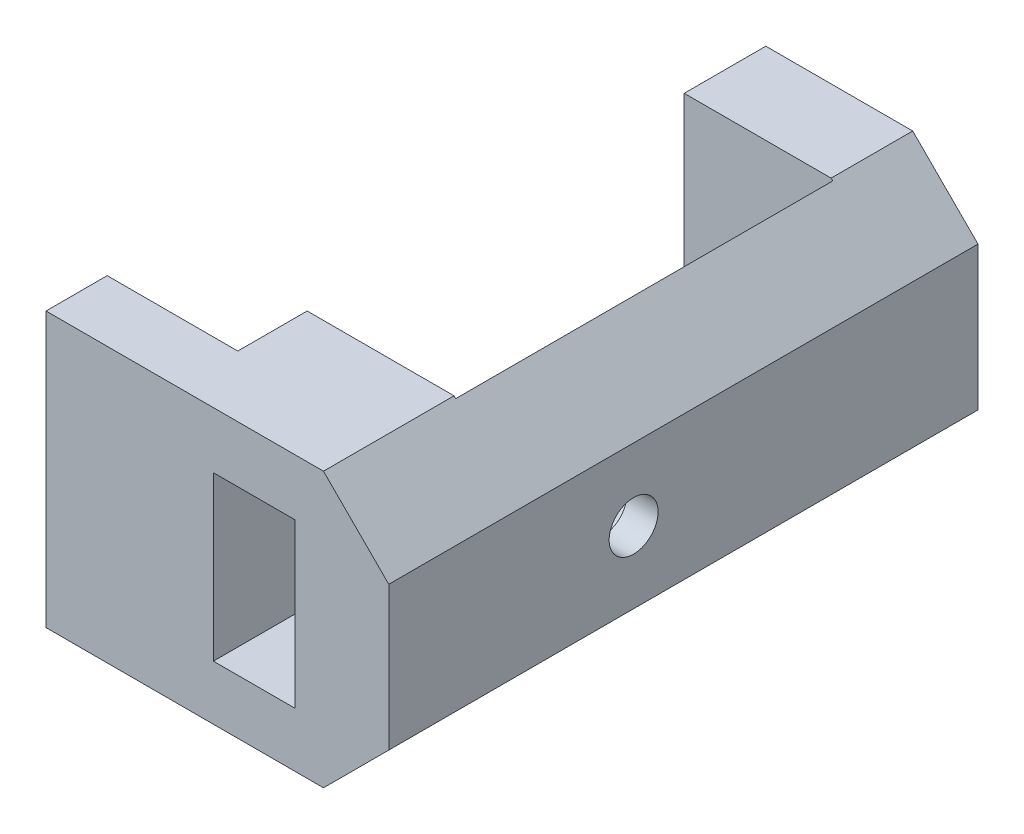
SolidWorks part; units mm, degrees
ref_plane "Front" through (0, 0, 0) normal (0, 0, 1) x (1, 0, 0)
ref_plane "Top" through (0, 0, 0) normal (0, 1, 0) x (1, 0, 0)
ref_plane "Right" through (0, 0, 0) normal (1, 0, 0) x (0, 0, -1)
sketch "Sketch1" plane through (0, 0, 0) normal (0, 1, 0) x (1, 0, 0)
  line L0 (0, 0) -> (13, 0)
  line L1 (13, 0) -> (13, 33.1)
  line L2 (0, 0) -> (0, 5)
  line L3 (0, 5) -> (9.1, 5)
  line L4 (9.1, 5) -> (9.1, 28.1)
  line L5 (13, 16.55) -> (-7.0543, 16.55) construction
  line L6 (0, 28.1) -> (9.1, 28.1)
  line L7 (0, 33.1) -> (0, 28.1)
  line L8 (0, 33.1) -> (13, 33.1)
  point P12 (9.1, 16.55)
  dimension "D1" = 5
  dimension "D2" = 13
  dimension "D3" = 9.1
  dimension "D4" = 16.55
extrude "Boss-Extrude1" add sketch "Sketch1" along normal blind 16.8
sketch "Sketch3" plane through (13, 0, 0) normal (1, 0, 0) x (0, 0, -1)
  line L0 (0, 8.4) -> (33.1, 8.4) construction
  line L1 (0, 16.8) -> (0, 0) construction
  line L2 (33.1, 16.8) -> (33.1, 0) construction
  circle A0 centre (12, 8.4) radius 1.5
  dimension "D1" = 3
  dimension "D2" = 12
extrude "Cut-Extrude2" cut sketch "Sketch3" against normal blind 10
sketch "Sketch5" plane through (9.1, 0, 0) normal (-1, 0, 0) x (0, 0, 1)
  line L1 (-13.9861, 11.8278) -> (-15.8738, 7.5703)
  line L2 (-15.8738, 7.5703) -> (-12.408, 4.4595)
  line L3 (-12.408, 4.4595) -> (-8.3784, 6.7943)
  line L4 (-8.3784, 6.7943) -> (-9.3537, 11.3482)
  line L5 (-9.3537, 11.3482) -> (-13.9861, 11.8278)
  circle A0 centre (-12, 8.4) radius 3.205 construction
  dimension "D1" = 6.41
extrude "Cut-Extrude4" cut sketch "Sketch5" against normal blind 2
chamfer "Chamfer1" distance 4 angle 45 2 edges at (13, 16.8, -16.55) (13, 0, -16.55)
sketch "Sketch7" plane through (0, 0, 0) normal (0, 0, 1) x (1, 0, 0)
  line L0 (0, 0) -> (9, 0)
  line L1 (9, 0) -> (13, 4)
  line L2 (13, 4) -> (13, 12.8)
  line L3 (13, 12.8) -> (9, 16.8)
  line L4 (9, 16.8) -> (0, 16.8)
  line L5 (0, 16.8) -> (0, 0)
extrude "Boss-Extrude2" add sketch "Sketch7" along normal blind 3
sketch "Sketch6" plane through (0, 0, 0) normal (-1, 0, 0) x (0, 0, 1)
  line L0 (-5, 16.8) -> (3, 16.8) construction
  line L1 (-5, 0) -> (-0.75, 0)
  line L2 (-5, 0) -> (-5, 16.8)
  line L3 (-5, 16.8) -> (-0.75, 16.8)
  line L4 (-0.75, 0) -> (-0.75, 16.8)
  line L9 (-0.75, 0) -> (-0.75, 16.8)
  line L10 (-0.75, 16.8) -> (3, 16.8)
  line L11 (-0.75, 16.8) -> (-0.75, 0)
  line L12 (-0.75, 0) -> (3, 0)
  line L13 (3, 16.8) -> (3, 0)
  dimension "D1" = 4.25
extrude "Boss-Extrude3" add sketch "Sketch6" along normal blind 8 contours L4 M2 M15 M4
sketch "Sketch8" plane through (0, 0, 3) normal (0, 0, 1) x (1, 0, 0)
  line L5 (7.2561, 13.3482) -> (7.2561, 3.3482)
  line L6 (7.2561, 3.3482) -> (2.2561, 3.3482)
  line L7 (2.2561, 13.3482) -> (2.2561, 3.3482)
  line L8 (7.2561, 13.3482) -> (2.2561, 13.3482)
  dimension "D1" = 10
extrude "Cut-Extrude7" cut sketch "Sketch8" against normal blind 8
sketch "Sketch9" plane through (0, 0, 0) normal (-1, 0, 0) x (0, 0, 1)
  circle A0 centre (-30.6, 8.4) radius 1
  dimension "D1" = 2
extrude "Cut-Extrude8" cut sketch "Sketch9" against normal blind 6
